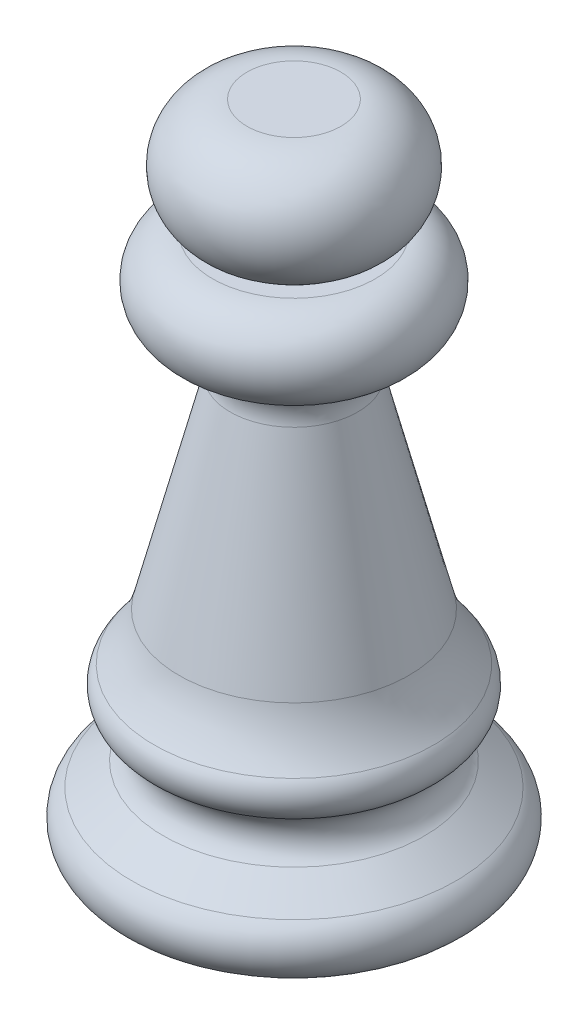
SolidWorks part; units mm, degrees
ref_plane "Front" through (0, 0, 0) normal (0, 0, 1) x (1, 0, 0)
ref_plane "Top" through (0, 0, 0) normal (0, 1, 0) x (1, 0, 0)
ref_plane "Right" through (0, 0, 0) normal (1, 0, 0) x (0, 0, -1)
sketch "Sketch1" plane through (0, 0, 0) normal (0, 0, 1) x (1, 0, 0)
  line L0 (0, 0) -> (0, 72.0534) construction
  line L1 (0, 0) -> (13.97, 0)
  line L2 (15.7696, 5.508) -> (12.6946, 7.7575)
  line L3 (11.188, 20.5348) -> (6.1971, 40.2324)
  line L4 (7.922, 52.324) -> (4.572, 52.324)
  line L5 (4.572, 63.5) -> (0, 63.5)
  line L6 (0, 63.5) -> (0, 0)
  arc A0 (13.97, 0) -> (15.7696, 5.508) centre (13.97, 3.048) ccw
  arc A1 (12.6946, 7.7575) -> (12.9391, 12.0158) centre (14.1943, 9.8076) cw
  arc A2 (12.9391, 12.0158) -> (13.6083, 15.8819) centre (11.684, 14.224) ccw
  arc A3 (13.6083, 15.8819) -> (11.188, 20.5348) centre (22.2679, 23.3422) cw
  arc A4 (6.1971, 40.2324) -> (8.7363, 44.2784) centre (9.398, 41.0434) cw
  arc A5 (8.7363, 44.2784) -> (7.922, 52.324) centre (7.922, 48.26) ccw
  arc A6 (4.572, 52.324) -> (4.572, 63.5) centre (4.572, 57.912) ccw
  dimension "D2" = 3.048
  dimension "D4" = 2.54
  dimension "D5" = 11.43
  dimension "D7" = 3.302
  dimension "D8" = 4.064
  dimension "D9" = 5.588
  dimension "D11" = 7.922
  dimension "D12" = 14.224
  dimension "D13" = 11.684
  dimension "D14" = 13.97
  dimension "D15" = 9.398
  dimension "D1" = 63.5
  dimension "D3" = 3.81
  dimension "D6" = 20.32
  dimension "D10" = 4.572
revolve "Base-Revolve" add sketch "Sketch1" angle 360 about L0
